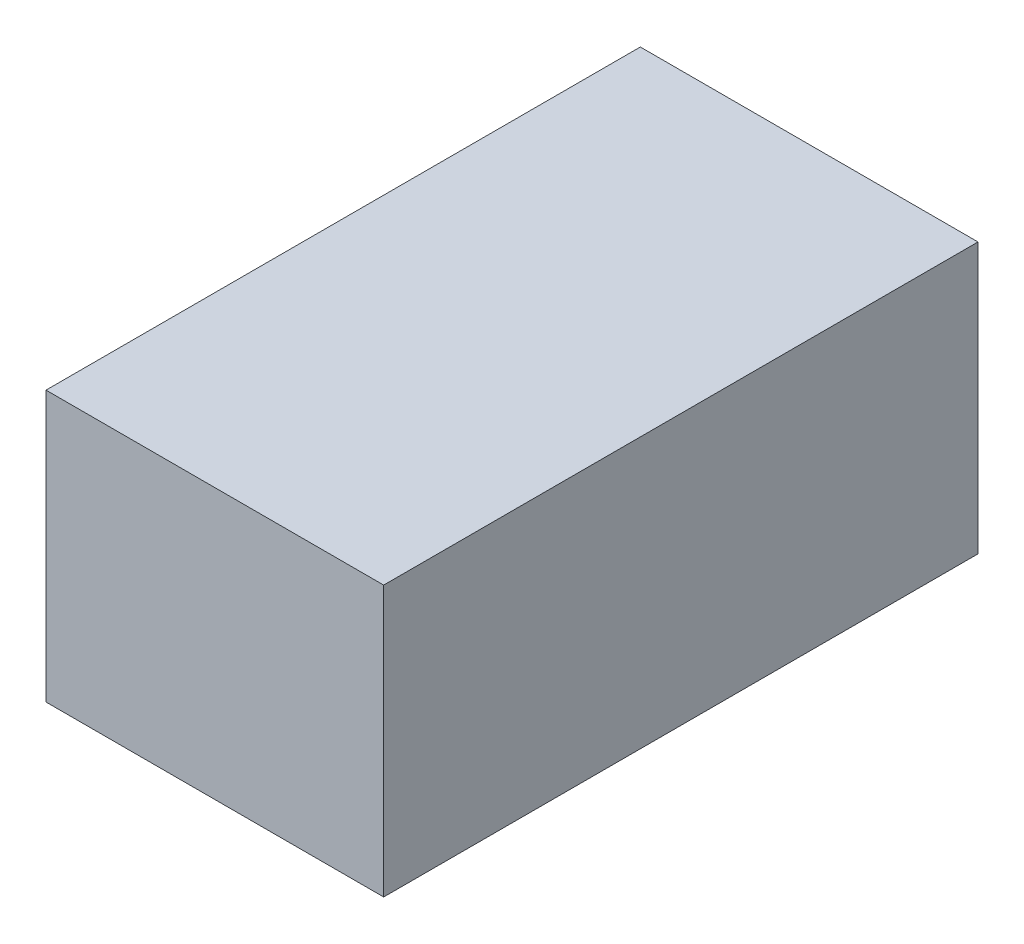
SolidWorks part; units mm, degrees
ref_plane "Plan de face" through (0, 0, 0) normal (0, 0, 1) x (1, 0, 0)
ref_plane "Plan de dessus" through (0, 0, 0) normal (0, 1, 0) x (1, 0, 0)
ref_plane "Plan de droite" through (0, 0, 0) normal (1, 0, 0) x (0, 0, -1)
sketch "Esquisse1" plane through (0, 0, 0) normal (0, 1, 0) x (1, 0, 0)
  line L1 (0.625, -1.1) -> (-0.625, -1.1)
  line L2 (0.625, -1.1) -> (0.625, 1.1)
  line L3 (0.625, 1.1) -> (-0.625, 1.1)
  line L4 (-0.625, -1.1) -> (-0.625, 1.1)
  line L5 (0.625, -1.1) -> (-0.625, 1.1) construction
  line L6 (0.625, 1.1) -> (-0.625, -1.1) construction
  point P0 (0, 0)
  dimension "D1" = 1.25
  dimension "D2" = 2.2
extrude "Boss.-Extru.1" add sketch "Esquisse1" along normal blind 1
